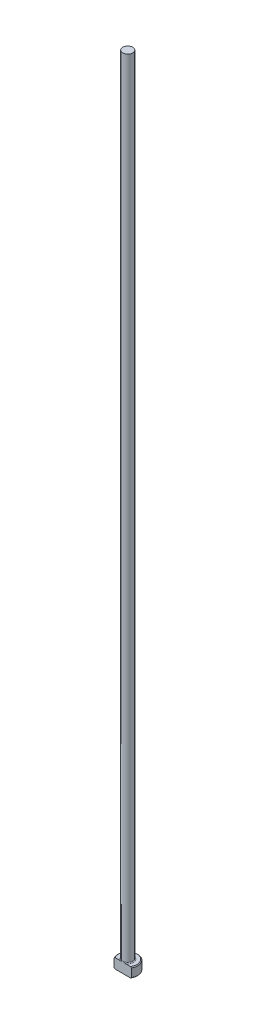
SolidWorks part; units mm, degrees
ref_plane "Front Plane" through (0, 0, 0) normal (0, 0, 1) x (1, 0, 0)
ref_plane "Top Plane" through (0, 0, 0) normal (0, 1, 0) x (1, 0, 0)
ref_plane "Right Plane" through (0, 0, 0) normal (1, 0, 0) x (0, 0, -1)
sketch "Sketch1" plane through (0, 0, 0) normal (0, 0, 1) x (1, 0, 0)
  line L0 (0, 259.9588) -> (0, -15.1925) construction
  line L1 (0, 0) -> (-3.175, 0)
  line L2 (-3.175, 0) -> (-3.175, 3.175)
  line L3 (-3.175, 3.175) -> (-1.5875, 3.175)
  line L4 (-1.5875, 3.175) -> (-1.5875, 254)
  line L5 (-1.5875, 254) -> (0, 254)
  line L6 (0, 254) -> (0, 0)
  dimension "L" = 254
  dimension "H" = 6.35
  dimension "T" = 3.175
  dimension "D" = 3.175
revolve "Revolve1" add sketch "Sketch1" angle 360 about L0
chamfer "Chamfer1" distance 0.254 angle 45 2 edges at (0, 3.175, 3.175) (0, 0, 3.175)
fillet "Fillet1" radius 0.254 1 edges at (0, 3.175, 1.5875)
sketch "Sketch2" plane through (0, 0, 0) normal (0, -1, 0) x (1, 0, 0)
  line L0 (-2.7496, 1.5875) -> (2.7496, 1.5875)
  arc A0 (2.7496, 1.5875) -> (-2.7496, 1.5875) centre (0, 0) ccw
  circle A1 centre (0, 0) radius 3.175 construction
  circle A3 centre (0, 0) radius 1.5875 construction
extrude "KEY" cut sketch "Sketch2" against normal through all
sketch "Pocket Sketch" plane through (0, 0, 0) normal (0, 0, 1) x (1, 0, 0)
  line L0 (-3.5719, 0) -> (-3.5719, 3.2004)
  line L1 (-3.5719, 3.2004) -> (-2.5479, 3.2004)
  line L2 (-1.7859, 3.9624) -> (-1.7859, 22.225)
  line L3 (-1.7859, 22.225) -> (0, 22.225)
  line L4 (0, 22.225) -> (0, 0)
  line L5 (0, 0) -> (-3.5719, 0)
  line L6 (0, 12.6104) -> (0, -2.4989) construction
  line L7 (-3.175, 2.921) -> (-3.175, 0.254) construction
  line L8 (2.921, 3.175) -> (-2.921, 3.175) construction
  line L9 (-1.5875, 254) -> (-1.5875, 3.429) construction
  line L10 (-2.5479, 3.2004) -> (-1.7859, 3.9624)
  point P3 (-1.7859, 3.2004)
  dimension "D1" = 7.1437
  dimension "D2" = 0.3969
  dimension "D3" = 0.0254
  dimension "D4" = 0.1984
  dimension "D5" = 3.5719
  dimension "D6" = 22.225
